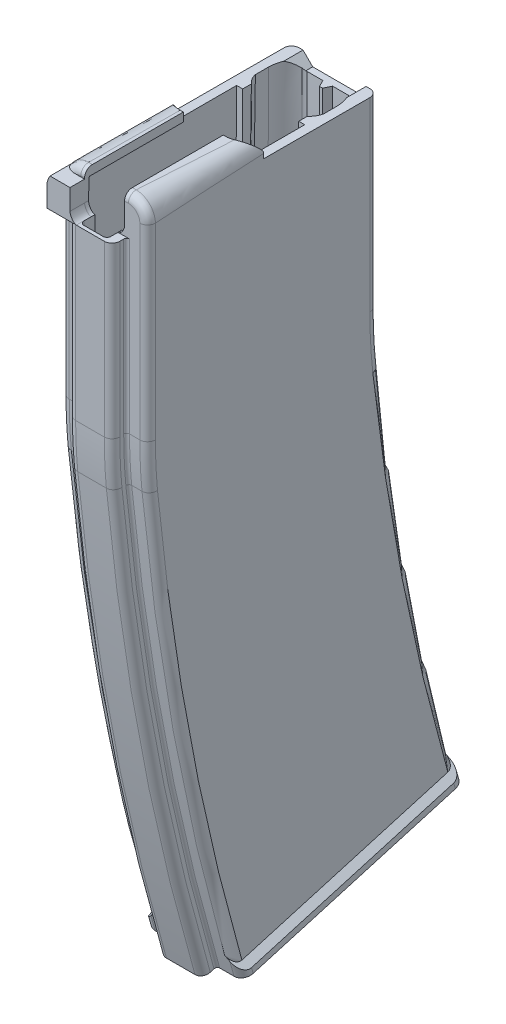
SolidWorks part; units mm, degrees
ref_plane "Front Plane" through (0, 0, 0) normal (0, 0, 1) x (1, 0, 0)
ref_plane "Top Plane" through (0, 0, 0) normal (0, 1, 0) x (1, 0, 0)
ref_plane "Right Plane" through (0, 0, 0) normal (1, 0, 0) x (0, 0, -1)
imported_body "Imported3"
sketch "Sketch1" plane through (11.2522, 0, 0) normal (1, 0, 0) x (0, 0, -1)
  line L0 (0, -59.69) -> (0, -9.9568)
  line L1 (0, -9.9568) -> (-3.81, -9.9568)
  line L2 (-3.81, -9.9568) -> (-3.81, -59.8501)
  line L3 (19.8871, -187.673) -> (23.5458, -186.6101)
  arc A0 (-3.81, -59.8501) -> (19.8871, -187.673) centre (648.6677, -4.9954) ccw
  arc A1 (23.5458, -186.6101) -> (0, -59.69) centre (648.6677, -4.9954) cw
extrude "Cut-Extrude1" cut sketch "Sketch1" against normal blind 5.4864
sketch "Sketch2" plane through (11.2522, 0, 0) normal (1, 0, 0) x (0, 0, -1)
  line L0 (23.1034, -185.0802) -> (80.7893, -168.3209)
  line L1 (81.2316, -169.8508) -> (23.5458, -186.6101)
  arc A0 (80.7893, -168.3209) -> (81.2316, -169.8508) centre (661.4186, -1.2909) ccw
  arc A1 (23.5458, -186.6101) -> (23.1034, -185.0802) centre (648.6677, -4.9954) cw
extrude "Boss-Extrude1" add sketch "Sketch2" along normal blind 1.5824
sketch "Sketch3" plane through (0, 0, 3.81) normal (0, 0, 1) x (1, 0, 0)
  line L0 (-11.2522, -2.286) -> (-11.2522, -9.9568)
  line L1 (-11.2522, -9.9568) -> (-3.5687, -9.9568)
  line L2 (-5.2197, -7.6708) -> (-5.2197, -2.286)
  line L3 (-5.2197, -2.286) -> (-11.2522, -2.286)
  spline S0 degree 3 poles (-3.5687, -9.9568) (-4.4167, -9.9568) (-5.2197, -8.5729) (-5.2197, -7.6708) knots 0 0 0 0 1 1 1 1
extrude "Cut-Extrude2" cut sketch "Sketch3" against normal blind 3.81
ref_plane "Plane1" through (3.5141, 0, 0) normal (1, 0, 0) x (0, 0, -1)
sketch "Sketch4" plane through (3.5141, 0, 0) normal (1, 0, 0) x (0, 0, -1)
  line L0 (0.9894, -9.9568) -> (-2.8798, -9.9568)
  line L1 (21.0981, -187.3212) -> (24.813, -186.2419)
  arc A0 (24.813, -186.2419) -> (0.9894, -9.9568) centre (578.7979, -21.6226) cw
  arc A1 (-2.8798, -9.9568) -> (21.0981, -187.3212) centre (578.7979, -21.6226) ccw
extrude "Cut-Extrude3" cut sketch "Sketch4" against normal blind 7.0282
sketch "Sketch5" plane through (-11.2522, 0, 0) normal (-1, 0, 0) x (0, 0, 1)
  line L0 (3.81, -59.8501) -> (3.81, -9.9568)
  line L1 (3.81, -9.9568) -> (0, -9.9568)
  line L2 (0, -9.9568) -> (0, -59.69)
  line L3 (-23.5458, -186.6101) -> (-19.8871, -187.673)
  arc A0 (0, -59.69) -> (-23.5458, -186.6101) centre (-648.6677, -4.9954) cw
  arc A1 (-19.8871, -187.673) -> (3.81, -59.8501) centre (-648.6677, -4.9954) ccw
extrude "Cut-Extrude4" cut sketch "Sketch5" against normal blind 5.4864
sketch "Sketch6" plane through (0, -2.286, 0) normal (0, 1, 0) x (-1, 0, 0)
  line L0 (-11.2522, 0) -> (-5.2197, 0)
  line L1 (-5.2197, 0) -> (-5.2197, -25.7912)
  line L2 (-5.2197, -25.7912) -> (-6.7615, -25.7912)
  line L3 (-11.2522, -30.3198) -> (-11.2522, 0)
  arc A0 (-6.7615, -25.7912) -> (-11.2522, -30.3198) centre (-4.9954, -32.0333) ccw
extrude "Boss-Extrude2" add sketch "Sketch6" along normal blind 2.286
sketch "Sketch7" plane through (0, -2.286, 0) normal (0, 1, 0) x (-1, 0, 0)
  line L0 (6.7615, -25.7912) -> (5.2197, -25.7912)
  line L1 (5.2197, -25.7912) -> (5.2197, 0)
  line L2 (5.2197, 0) -> (11.2522, 0)
  line L3 (11.2522, 0) -> (11.2522, -30.3198)
  arc A0 (11.2522, -30.3198) -> (6.7615, -25.7912) centre (4.9954, -32.0333) ccw
extrude "Boss-Extrude3" add sketch "Sketch7" along normal blind 2.286
sketch "Sketch8" plane through (-11.2522, 0, 0) normal (-1, 0, 0) x (0, 0, 1)
  line L0 (-80.3573, -166.8117) -> (-22.6709, -183.5712)
  line L1 (-23.5458, -186.6101) -> (-81.2316, -169.8508)
  arc A0 (-22.6709, -183.5712) -> (-23.5458, -186.6101) centre (-648.6677, -4.9954) cw
  arc A1 (-81.2316, -169.8508) -> (-80.3573, -166.8117) centre (-661.4186, -1.2909) ccw
extrude "Boss-Extrude4" add sketch "Sketch8" along normal blind 1.5824
ref_plane "Plane2" through (0, 0, -9.398) normal (0, 0, 1) x (1, 0, 0)
sketch "Sketch9" plane through (0, 0, -9.398) normal (0, 0, 1) x (1, 0, 0)
  line L0 (-11.2522, -34.7218) -> (-12.3673, -34.7218)
  line L1 (-12.3673, -34.7218) -> (-11.2522, -38.9266)
  line L2 (-11.2522, -38.9266) -> (-11.2522, -34.7218)
extrude "Boss-Extrude5" add sketch "Sketch9" against normal blind 10.795
ref_plane "Plane3" through (0, 0, -20.193) normal (0, 0, -1) x (-1, 0, 0)
sketch "Sketch10" plane through (0, 0, -20.193) normal (0, 0, -1) x (-1, 0, 0)
  line L0 (11.2522, -26.4668) -> (9.4742, -26.4668)
  line L1 (9.4742, -26.4668) -> (9.4742, -34.7218)
  line L2 (9.4742, -34.7218) -> (11.2522, -34.7218)
  line L3 (11.2522, -34.7218) -> (11.2522, -26.4668)
extrude "Cut-Extrude5" cut sketch "Sketch10" against normal blind 10.795
draft "Draft1" type of draft neutral plane draft angle 44.769 faces to draft 1 parameters "D1"=44.769
draft "Draft2" type of draft neutral plane draft angle 45 faces to draft 1 parameters "D1"=45
draft "Draft3" type of draft neutral plane draft angle 44.769 faces to draft 1 parameters "D1"=44.769
fillet "Fillet1" radius 127 4 edges at (0, -59.69, -60.071) (-8.509, -59.69, 0) (8.509, -59.69, 0) (0, -59.8501, 3.81)
fillet "VarFillet1" radius 5.0473 1 edges at (-11.2522, 0, -15.1599)
fillet "VarFillet2" radius 3.41 1 edges at (11.2522, 0, -15.1599)
fillet "VarFillet3" radius 1.3526 1 edges
fillet "VarFillet4" radius 2.6883 1 edges
fillet "Fillet2" radius 0.2541 4 edges at (-8.9027, -96.5512, -5.7495) (8.9027, -96.5512, -5.7495)
fillet "Fillet3" radius 0.762 6 edges at (-5.7658, -126.8215, -9.1994) (-5.7658, -32.0059, 0) (-5.7658, -60.0071, -0.1396) (5.7658, -126.8215, -9.1994) (5.7658, -60.0071, -0.1396) (5.7658, -32.0059, 0)
fillet "Fillet4" radius 1.016 2 edges at (-3.5141, -99.5665, -2.248) (3.5141, -99.5665, -2.248)
fillet "Fillet5" radius 2.032 22 edges at (11.2522, -125.2679, -8.9054) (11.2522, -60.0071, -0.1396) (11.2522, -29.5511, 0) (10.1234, -1.8659, 0) (5.7123, 0, 0) (-11.2522, -29.2005, -60.071) (-11.2522, -60.0889, -60.2594) (-11.2522, -117.3092, -68.4859) (-5.7658, -32.0951, 3.81) (-5.7658, -60.164, 3.6715) (-5.7658, -127.4254, -5.436) (5.7658, -127.4254, -5.436) (5.7658, -60.164, 3.6715) (5.7658, -32.0951, 3.81) (-5.7123, 0, 0) (-7.8756, -0.2845, 0) (-11.2522, -32.0059, 0) (-11.2522, -60.0071, -0.1396) (-11.2522, -125.2679, -8.9054) (11.2522, -117.3092, -68.4859) (11.2522, -60.0889, -60.2594) (11.2522, -28.9049, -60.071)
fillet "Fillet6" radius 2.54 4 edges at (12.8346, -169.086, -81.0099) (12.8346, -185.8452, -23.3241) (-12.8346, -185.8452, -23.3241) (-12.8346, -169.086, -81.0099)
fillet "Fillet7" radius 5.08 2 edges at (-6.7615, -1.1683, -25.7912) (6.7615, -1.1711, -25.7912)
